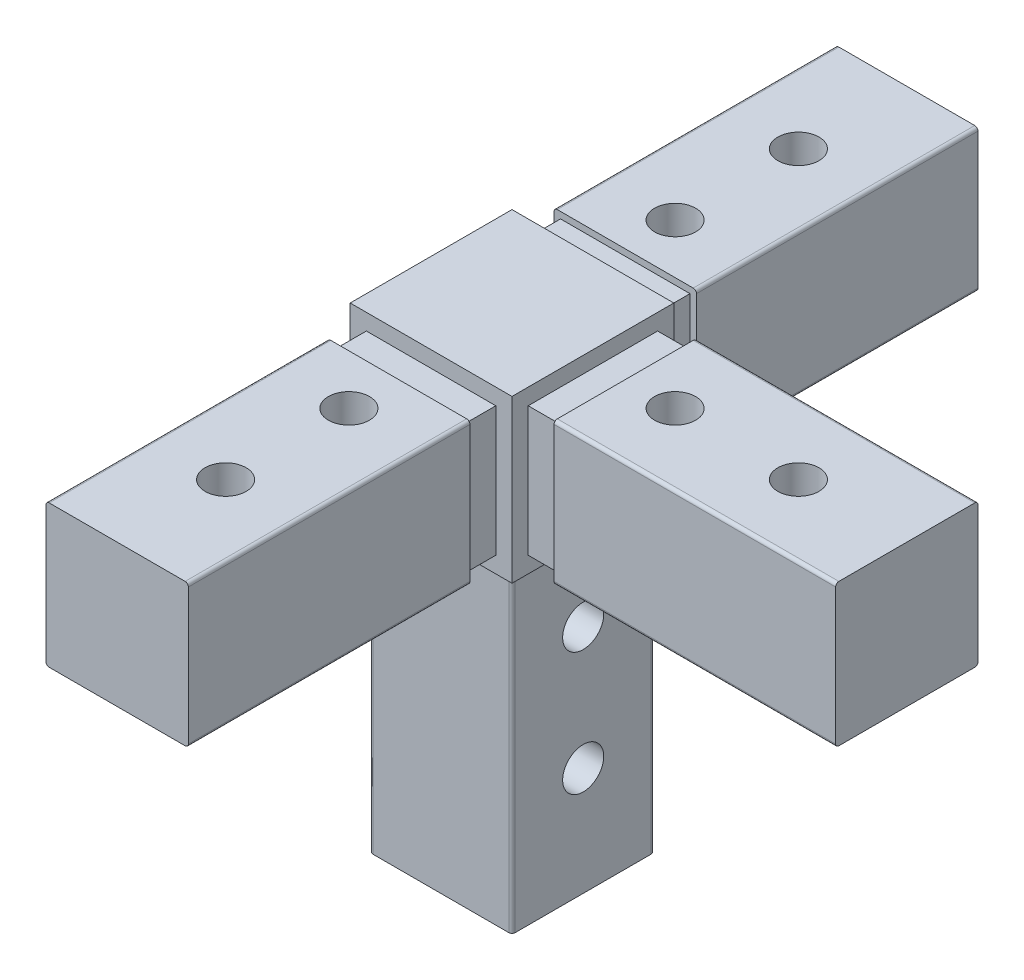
SolidWorks part; units mm, degrees
ref_plane "Front Plane" through (0, 0, 0) normal (0, 0, 1) x (1, 0, 0)
ref_plane "Top Plane" through (0, 0, 0) normal (0, 1, 0) x (1, 0, 0)
ref_plane "Right Plane" through (0, 0, 0) normal (1, 0, 0) x (0, 0, -1)
imported_body "Imported2"
sketch "Sketch1" plane through (0, -10, 0) normal (0, -1, 0) x (1, 0, 0)
  line L0 (-10, -17.5) -> (12.5, -17.5)
  line L1 (12.5, -17.5) -> (12.5, 12.5)
  line L2 (12.5, 12.5) -> (-10, 12.5)
  line L3 (-10, 12.5) -> (-10, -17.5)
extrude "Boss-Extrude1" add sketch "Sketch1" along normal blind 20
sketch "Sketch2" plane through (12.5, 0, 0) normal (1, 0, 0) x (0, 0, -1)
  line L0 (12.5, 10) -> (12.5, -10)
  line L1 (12.5, -10) -> (17.5, -10)
  line L2 (17.5, -10) -> (17.5, 10)
  line L3 (17.5, 10) -> (12.5, 10)
extrude "Cut-Extrude1" cut sketch "Sketch2" against normal blind 2.5
sketch "Sketch3" plane through (12.5, 0, 0) normal (1, 0, 0) x (0, 0, -1)
  line L0 (-10, 10) -> (10, 10)
  line L1 (10, 10) -> (10, -10)
  line L2 (10, -10) -> (-10, -10)
  line L3 (-10, -10) -> (-10, 10)
extrude "Boss-Extrude2" add sketch "Sketch3" along normal blind 5
sketch "Sketch4" plane through (17.5, 0, 0) normal (1, 0, 0) x (0, 0, -1)
  line L0 (11, -10) -> (-10, -10)
  line L1 (-10, -10) -> (-10, 11)
  line L2 (-10, 11) -> (11, 11)
  line L3 (11, 11) -> (11, -10)
extrude "Boss-Extrude3" add sketch "Sketch4" along normal blind 43.5
sketch "Sketch5" plane through (0, 0, -17.5) normal (0, 0, -1) x (-1, 0, 0)
  line L0 (11, 11) -> (11, -11)
  line L1 (11, -11) -> (-11, -11)
  line L2 (-11, -11) -> (-11, 11)
  line L3 (-11, 11) -> (11, 11)
extrude "Boss-Extrude4" add sketch "Sketch5" along normal blind 43.5
ref_plane "Plane1" through (0, -10, 0) normal (0, 1, 0) x (1, 0, 0)
sketch "Sketch6" plane through (0, -10, 0) normal (0, 1, 0) x (1, 0, 0)
  line L0 (-10, -12.5) -> (12.5, -12.5)
  line L1 (12.5, -12.5) -> (12.5, 12.5)
  line L2 (12.5, 12.5) -> (-10, 12.5)
  line L3 (-10, 12.5) -> (-10, -12.5)
extrude "Boss-Extrude5" add sketch "Sketch6" against normal blind 2.5
sketch "Sketch7" plane through (-10, 0, 0) normal (-1, 0, 0) x (0, 0, 1)
  line L0 (12.5, 10) -> (12.5, -12.5)
  line L1 (12.5, -12.5) -> (-12.5, -12.5)
  line L2 (-12.5, -12.5) -> (-12.5, 10)
  line L3 (-12.5, 10) -> (12.5, 10)
extrude "Boss-Extrude6" add sketch "Sketch7" along normal blind 2.5
sketch "Sketch8" plane through (0, 10, 0) normal (0, 1, 0) x (-1, 0, 0)
  line L0 (12.5, -12.5) -> (-12.5, -12.5)
  line L1 (-12.5, -12.5) -> (-12.5, 12.5)
  line L2 (-12.5, 12.5) -> (12.5, 12.5)
  line L3 (12.5, 12.5) -> (12.5, -12.5)
extrude "Boss-Extrude7" add sketch "Sketch8" along normal blind 2.5
sketch "Sketch9" plane through (0, 0, 12.5) normal (0, 0, 1) x (1, 0, 0)
  line L0 (-10, 10) -> (10, 10)
  line L1 (10, 10) -> (10, -10)
  line L2 (10, -10) -> (-10, -10)
  line L3 (-10, -10) -> (-10, 10)
extrude "Boss-Extrude8" add sketch "Sketch9" along normal blind 48.5
sketch "Sketch10" plane through (0, 10, 0) normal (0, 1, 0) x (-1, 0, 0)
  line L0 (-10, 61) -> (10, 61)
  line L1 (10, 61) -> (10, 17.5)
  line L2 (10, 17.5) -> (-10, 17.5)
  line L3 (-10, 17.5) -> (-10, 61)
extrude "Boss-Extrude9" add sketch "Sketch10" along normal blind 1
sketch "Sketch11" plane through (10, 0, 0) normal (1, 0, 0) x (0, 0, -1)
  line L0 (-61, -10) -> (-61, 11)
  line L1 (-61, 11) -> (-17.5, 11)
  line L2 (-17.5, 11) -> (-17.5, -10)
  line L3 (-17.5, -10) -> (-61, -10)
extrude "Boss-Extrude10" add sketch "Sketch11" along normal blind 1
sketch "Sketch12" plane through (0, -10, 0) normal (0, -1, 0) x (1, 0, 0)
  line L0 (-10, 61) -> (11, 61)
  line L1 (11, 61) -> (11, 17.5)
  line L2 (11, 17.5) -> (-10, 17.5)
  line L3 (-10, 17.5) -> (-10, 61)
extrude "Boss-Extrude11" add sketch "Sketch12" along normal blind 1
sketch "Sketch13" plane through (-10, 0, 0) normal (-1, 0, 0) x (0, 0, 1)
  line L0 (61, 11) -> (61, -11)
  line L1 (61, -11) -> (17.5, -11)
  line L2 (17.5, -11) -> (17.5, 11)
  line L3 (17.5, 11) -> (61, 11)
extrude "Boss-Extrude12" add sketch "Sketch13" along normal blind 1
sketch "Sketch14" plane through (0, -10, 0) normal (0, -1, 0) x (1, 0, 0)
  line L0 (61, 10) -> (61, -11)
  line L1 (61, -11) -> (17.5, -11)
  line L2 (17.5, -11) -> (17.5, 10)
  line L3 (17.5, 10) -> (61, 10)
extrude "Boss-Extrude13" add sketch "Sketch14" along normal blind 1
sketch "Sketch15" plane through (0, 0, 10) normal (0, 0, 1) x (1, 0, 0)
  line L0 (61, 11) -> (61, -11)
  line L1 (61, -11) -> (17.5, -11)
  line L2 (17.5, -11) -> (17.5, 11)
  line L3 (17.5, 11) -> (61, 11)
extrude "Boss-Extrude14" add sketch "Sketch15" along normal blind 1
sketch "Sketch16" plane through (0, -12.5, 0) normal (0, -1, 0) x (1, 0, 0)
  line L0 (-11, 11) -> (11, 11)
  line L1 (11, 11) -> (11, -11)
  line L2 (11, -11) -> (-11, -11)
  line L3 (-11, -11) -> (-11, 11)
extrude "Boss-Extrude15" add sketch "Sketch16" along normal blind 48.5
fillet "Fillet1" radius 0.5 16 edges at (39.25, -11, 11) (-11, -36.75, -11) (11, -45.5, 11) (11, -11, 39.25) (11, 11, 39.25) (39.25, 11, -11) (-11, -36.75, 11) (-11, 11, 39.25) (11, -45.5, -11) (-11, 11, -39.25) (39.25, 11, 11) (11, 11, -39.25) (39.25, -11, -11) (11, -11, -39.25) (-11, -11, 39.25) (-11, -11, -39.25)
sketch "Sketch17" plane through (-10, 0, 0) normal (-1, 0, 0) x (0, 0, 1)
  line L0 (-12.5, -10) -> (-17.5, -10)
  line L1 (39.6, -10) -> (-39.6, -10) construction
  line L2 (-12.5, 12.5) -> (-12.5, -12.5) construction
  line L3 (-17.5, 10) -> (-17.5, -11) construction
  line L4 (-17.5, -10) -> (-17.5, -30)
  line L5 (-17.5, -30) -> (-11, -30)
  line L6 (-11, -30) -> (-11, -12.5)
  line L7 (-11, -12.5) -> (-12.5, -12.5)
  line L8 (-12.5, -12.5) -> (-12.5, -10)
  line L9 (11, -12.5) -> (12.5, -12.5)
  line L10 (12.5, -12.5) -> (12.5, -30)
  line L11 (12.5, -30) -> (11, -30)
  line L12 (11, -30) -> (11, -12.5)
extrude "Cut-Extrude2" cut sketch "Sketch17" against normal up to surface (22.5 mm away)
sketch "Sketch19" plane through (0, -30, 0) normal (0, -1, 0) x (1, 0, 0)
  line L0 (12.5, 11) -> (12.5, -11)
  line L1 (12.5, -11) -> (10.5, -11)
  line L2 (12.5, -11) -> (10.5, -11) construction
  line L3 (11, -10.5) -> (11, 10.5)
  line L4 (10.5, 11) -> (12.5, 11)
  arc A0 (10.5, -11) -> (11, -10.5) centre (10.5, -10.5) ccw construction
  arc A1 (10.5, -11) -> (11, -10.5) centre (10.5, -10.5) ccw
  arc A2 (11, 10.5) -> (10.5, 11) centre (10.5, 10.5) ccw
extrude "Cut-Extrude3" cut sketch "Sketch19" against normal up to surface (17.5 mm away)
sketch "Sketch20" plane through (-11, 0, 0) normal (-1, 0, 0) x (0, 0, 1)
  line L0 (0, -61) -> (0, -12.5) construction
  line L1 (10.5, -61) -> (-10.5, -61) construction
  line L2 (-12.5, -12.5) -> (12.5, -12.5) construction
  line L3 (10.5, -12.5) -> (-10.5, -12.5) construction
  circle A0 centre (0, -44.25) radius 3.175
  circle A1 centre (0, -25.2) radius 3.175
  dimension "D3" = 6.35
  dimension "D4" = 6.35
  dimension "D1" = 12.7
  dimension "D2" = 31.75
extrude "Cut-Extrude4" cut sketch "Sketch20" against normal up to surface (22 mm away)
sketch "Sketch21" plane through (0, 11, 0) normal (0, 1, 0) x (1, 0, 0)
  line L0 (17.5, 0) -> (61, 0) construction
  line L1 (17.5, 10) -> (17.5, -10) construction
  line L2 (61, 10.5) -> (61, -10.5) construction
  line L3 (0, 17.5) -> (0, 61) construction
  line L4 (-10.5, 17.5) -> (10.5, 17.5) construction
  line L5 (-10.5, 61) -> (10.5, 61) construction
  line L6 (0, -17.5) -> (0, -61) construction
  line L7 (10.5, -17.5) -> (-10.5, -17.5) construction
  line L8 (-10.5, -61) -> (10.5, -61) construction
  line L9 (10, 12.5) -> (-10, 12.5) construction
  line L10 (12.5, -10) -> (12.5, 10) construction
  line L11 (12.5, -12.5) -> (12.5, 12.5) construction
  line L12 (-12.5, -12.5) -> (12.5, -12.5) construction
  line L13 (10, -12.5) -> (-10, -12.5) construction
  circle A0 centre (25.2, 0) radius 3.175
  circle A1 centre (44.25, 0) radius 3.175
  circle A2 centre (0, 25.2) radius 3.175
  circle A3 centre (0, 44.25) radius 3.175
  circle A4 centre (0, -25.2) radius 3.175
  circle A5 centre (0, -44.25) radius 3.175
  dimension "D3" = 6.35
  dimension "D4" = 6.35
  dimension "D7" = 6.35
  dimension "D8" = 6.35
  dimension "D11" = 6.35
  dimension "D12" = 6.35
  dimension "D1" = 12.7
  dimension "D2" = 31.75
  dimension "D5" = 12.7
  dimension "D6" = 31.75
  dimension "D9" = 12.7
  dimension "D10" = 31.75
extrude "Cut-Extrude5" cut sketch "Sketch21" against normal up to surface (22 mm away)
